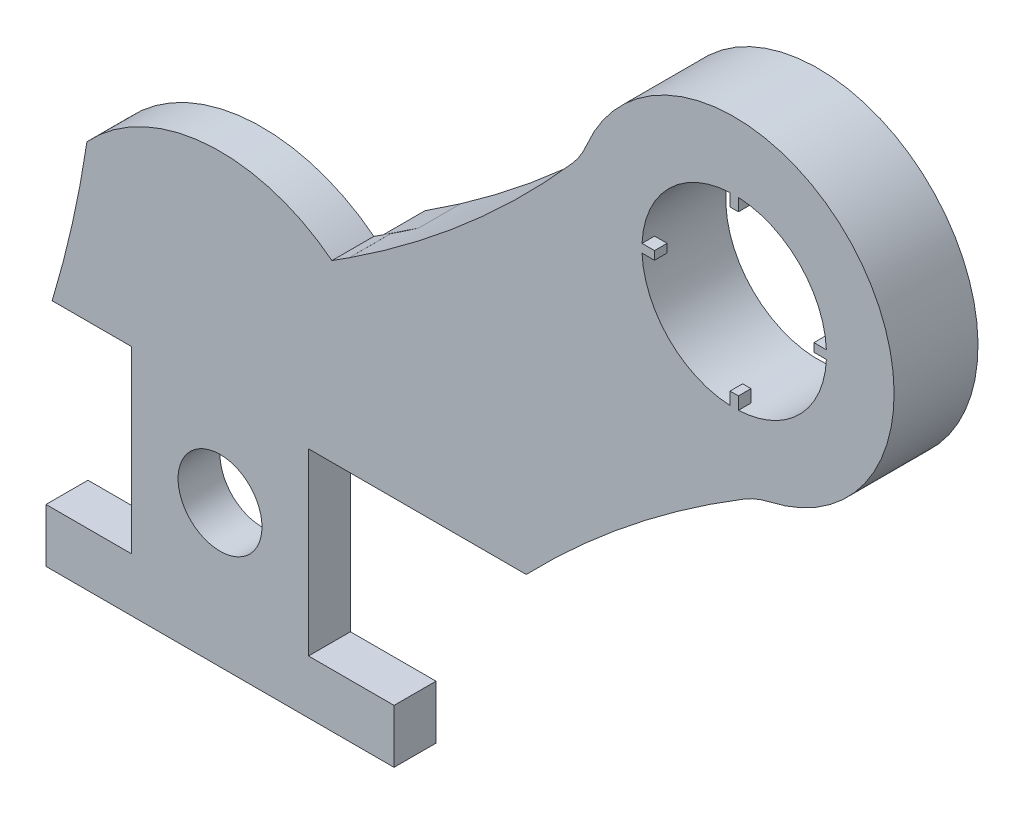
SolidWorks part; units mm, degrees
ref_plane "Front Plane" through (0, 0, 0) normal (0, 0, 1) x (1, 0, 0)
ref_plane "Top Plane" through (0, 0, 0) normal (0, 1, 0) x (1, 0, 0)
ref_plane "Right Plane" through (0, 0, 0) normal (1, 0, 0) x (0, 0, -1)
sketch "Sketch1" plane through (0, 0, 0) normal (0, 0, 1) x (1, 0, 0)
  line L0 (0, 0) -> (0, 70) construction
  line L1 (-53.033, -53.033) -> (0, 0) construction
  line L2 (0, 70) -> (16.2245, 70) construction
  line L3 (0, 70) -> (0, 50) construction
  line L4 (0, 70) -> (-16.2245, 70) construction
  line L5 (0, 0) -> (0, -95.7808) construction
  line L6 (0, 0) -> (53.033, -53.033) construction
  line L8 (-64.561, -58.9899) -> (67.8775, -58.9899) construction
  line L9 (-20.9932, 10.8458) -> (-10.5429, 10.8458) construction
  line L10 (-10.5429, 10.8458) -> (-10.5429, -10.5429) construction
  line L11 (-10.5429, -10.5429) -> (-20.7412, -10.5429) construction
  line L12 (-20.7412, -10.5429) -> (-20.7412, -16.9424) construction
  line L13 (20.7412, -10.5429) -> (20.7412, -16.9424) construction
  line L14 (10.5429, -10.5429) -> (20.7412, -10.5429) construction
  line L15 (10.5429, 10.8458) -> (10.5429, -10.5429) construction
  line L16 (20.9932, 10.8458) -> (10.5429, 10.8458) construction
  line L17 (-20.7412, -16.9424) -> (20.7412, -16.9424) construction
  line L18 (-63.2289, -53.033) -> (63.2289, -53.033) construction
  line L19 (0, 0) -> (-57.4533, -48.2091) construction
  line L20 (0, 0) -> (57.4533, -48.2091) construction
  circle A0 centre (0, 0) radius 5 construction
  arc A1 (-57.4533, -48.2091) -> (-16.2245, 70) centre (-144.7299, 48.5256) ccw
  arc A2 (57.4533, -48.2091) -> (16.2245, 70) centre (144.7299, 48.5256) cw
  arc A3 (-16.2245, 70) -> (16.2245, 70) centre (0, 80) cw
  arc A5 (57.4533, -48.2091) -> (-57.4533, -48.2091) centre (0, 0) cw
  point P20 (0, -106.066)
  dimension "D1" = 10
  dimension "D2" = 75
  dimension "D11" = 19.0587
  dimension "D3" = 70
  dimension "D4" = 5
  dimension "D5" = 5
  dimension "D6" = 41.4824
  dimension "D7" = 21.3887
  dimension "D8" = 6.3996
  dimension "D9" = 21.0858
  dimension "D10" = 6.3995
  dimension "D12" = 10
extrude "Body" add sketch "Sketch1" along normal blind 10
sketch "Sketch2" plane through (0, 0, 10) normal (0, 0, 1) x (1, 0, 0)
  circle A0 centre (0, 0) radius 5
  dimension "D1" = 10
extrude "Attachment Hole" cut sketch "Sketch2" against normal through all
sketch "Sketch17" plane through (0, 0, 10) normal (0, 0, 1) x (1, 0, 0)
  line L0 (-20.9932, 10.8458) -> (-10.5429, 10.8458)
  line L1 (-10.5429, 10.8458) -> (-10.5429, -10.5429)
  line L2 (-10.5429, -10.5429) -> (-20.7412, -10.5429)
  line L3 (-20.7412, -10.5429) -> (-20.7412, -16.9424)
  line L4 (-20.7412, -16.9424) -> (20.7412, -16.9424)
  line L5 (20.7412, -16.9424) -> (20.7412, -10.5429)
  line L6 (20.7412, -10.5429) -> (10.5429, -10.5429)
  line L7 (10.5429, -10.5429) -> (10.5429, 10.8458)
  line L8 (10.5429, 10.8458) -> (20.9932, 10.8458)
  line L9 (0, 0) -> (0, 42.2888) construction
  line L10 (0, 0) -> (0, 70) construction
  line L11 (0, 36.1313) -> (0, -16.9424) construction
  arc A0 (-20.9932, 10.8458) -> (-14.4605, 50.6859) centre (-174.762, 56.5155) ccw
  arc A1 (-57.4533, -48.2091) -> (-16.2245, 70) centre (-144.7299, 48.5256) ccw construction
  arc A2 (20.9932, 10.8458) -> (14.4605, 50.6859) centre (174.762, 56.5155) cw
  arc A3 (-14.4605, 50.6859) -> (14.4605, 50.6859) centre (0, 50.5921) cw
  dimension "D1" = 53.0738
sketch "Sketch34" plane through (0, 0, 10) normal (0, 0, 1) x (1, 0, 0)
  line L0 (-20.9932, 10.8458) -> (-10.5429, 10.8458)
  line L1 (-10.5429, 10.8458) -> (-10.5429, -10.5429)
  line L2 (-10.5429, -10.5429) -> (-20.7412, -10.5429)
  line L3 (-20.7412, -10.5429) -> (-20.7412, -16.9424)
  line L4 (-20.7412, -16.9424) -> (20.7412, -16.9424)
  line L5 (20.7412, -16.9424) -> (20.7412, -10.5429)
  line L6 (20.7412, -10.5429) -> (10.5429, -10.5429)
  line L7 (10.5429, -10.5429) -> (10.5429, 10.8458)
  line L8 (10.5429, 10.8458) -> (20.9932, 10.8458)
  arc A0 (-20.9932, 10.8458) -> (-57.4533, -48.2091) centre (-148.4496, 48.754) cw
  arc A1 (-57.4533, -48.2091) -> (57.4533, -48.2091) centre (0, 0) ccw
  arc A2 (57.4533, -48.2091) -> (20.9932, 10.8458) centre (209.9801, 86.7426) cw
extrude "Cut-Extrude28" cut sketch "Sketch34" against normal through all
sketch "Sketch35" plane through (0, 0, 0) normal (0, 0, -1) x (-1, 0, 0)
  line L0 (20.9932, 10.8458) -> (10.5429, 10.8458)
  line L1 (10.5429, 10.8458) -> (10.5429, -10.5429)
  line L2 (10.5429, -10.5429) -> (20.7412, -10.5429)
  line L3 (20.7412, -10.5429) -> (20.7412, -16.9424)
  line L4 (20.7412, -16.9424) -> (-20.7412, -16.9424)
  line L5 (-20.7412, -16.9424) -> (-20.7412, -10.5429)
  line L6 (-20.7412, -10.5429) -> (-10.5429, -10.5429)
  line L7 (-10.5429, -10.5429) -> (-10.5429, 10.8458)
  line L8 (-10.5429, 10.8458) -> (-20.9932, 10.8458)
  arc A0 (-16.8596, 28.7771) -> (16.8596, 28.7771) centre (0, 14.6091) cw
  arc A1 (-20.9932, 10.8458) -> (-16.8596, 28.7771) centre (-178.7447, 56.6532) ccw
  arc A2 (16.8596, 28.7771) -> (20.9932, 10.8458) centre (154.8947, 51.1552) ccw
extrude "Cut-Extrude30" cut sketch "Sketch35" against normal blind 5
fillet "Fillet1" radius 10 1 edges at (16.2245, 70, 5)
fillet "Fillet2" radius 10 1 edges at (-16.2245, 70, 5)
sketch "Sketch36" plane through (0, 0, 10) normal (0, 0, 1) x (1, 0, 0)
  line L0 (0, 99.0587) -> (0, -16.9424) construction
  line L1 (20.7412, -16.9424) -> (-20.7412, -16.9424) construction
  arc A0 (16.9333, 71.2537) -> (-16.9333, 71.2537) centre (0, 80) ccw construction
  circle A1 centre (0, 80) radius 11
  dimension "D1" = 22
extrude "Cut-Extrude31" cut sketch "Sketch36" against normal blind 10 contours A1
pattern_circular "CirPattern2" count 2 every 50 about axis through (0, 0, 0) along (0, 0, 1) of "Cut-Extrude28", "Cut-Extrude30", "Fillet1", "Fillet2", "Cut-Extrude31", "Body"
sketch "Sketch37" plane through (0, 0, 0) normal (0, 0, -1) x (-1, 0, 0)
  line L0 (10.5429, 10.8458) -> (34.076, 10.8458)
  line L5 (34.076, 10.8458) -> (33.8042, -11.1586)
  line L6 (33.8042, -11.1586) -> (20.7412, -10.5429)
  line L7 (20.7412, -10.5429) -> (10.5429, -10.5429)
  line L8 (20.7412, -10.5429) -> (10.5429, -10.5429) construction
  line L9 (10.5429, -10.5429) -> (10.5429, 10.8458) construction
  line L10 (10.5429, -10.5429) -> (10.5429, 10.8458)
  line L11 (-8.2483, -16.9424) -> (10.5429, -16.9424)
  line L12 (-20.7412, -16.9424) -> (20.7412, -16.9424) construction
  line L13 (10.5429, -16.9424) -> (10.5429, -32.1791)
  line L14 (10.5429, -32.1791) -> (-8.2483, -31.2934)
  line L15 (-8.2483, -31.2934) -> (-8.2483, -16.9424)
  line L16 (-20.7412, -10.5429) -> (-10.5429, -10.5429)
  line L17 (-10.5429, -10.5429) -> (-10.5429, 10.8458)
  line L18 (-10.5429, 10.8458) -> (-10.5429, -10.5429) construction
  line L19 (-10.5429, 10.8458) -> (-26.5425, 10.8458)
  line L20 (-26.5425, 10.8458) -> (-26.5425, -10.5429)
  line L21 (-26.5425, -10.5429) -> (-20.7412, -10.5429)
  line L22 (-23.6419, 102.3329) -> (-23.6419, 42.2679)
  line L23 (-23.6419, 42.2679) -> (50.9321, 42.2679)
  line L24 (50.9321, 42.2679) -> (49.6286, 108.6691)
  line L25 (49.6286, 108.6691) -> (-23.6419, 102.3329)
extrude "Cut-Extrude32" cut sketch "Sketch37" against normal blind 10
sketch "Sketch39" plane through (0, 0, 0) normal (0, 0, -1) x (-1, 0, 0)
  line L0 (-10.5429, 10.8458) -> (-54.2931, 10.8458)
  line L1 (-54.2931, 10.8458) -> (-54.2931, -6.5036)
  line L2 (-54.2931, -6.5036) -> (-10.5429, -4.6732)
  line L3 (-10.5429, 10.8458) -> (-10.5429, -10.5429) construction
  line L4 (-10.5429, -4.6732) -> (-10.5429, 10.8458)
extrude "Cut-Extrude33" cut sketch "Sketch39" against normal blind 10
sketch "Sketch40" plane through (0, 0, 0) normal (0, 0, -1) x (-1, 0, 0)
  line L0 (-15.7228, 46.4867) -> (31.5667, 45.4575)
  line L1 (31.5667, 45.4575) -> (21.2966, 18.2322)
  line L2 (-15.7228, 46.4867) -> (-15.7228, 33.1988)
  line L3 (-15.7228, 33.1988) -> (-13.3366, 31.6668)
  circle A0 centre (0, 14.6895) radius 21.5892
  arc A1 (-41.982, 56.0254) -> (-12.8313, 31.3516) centre (55.8578, 142.0611) ccw construction
extrude "Cut-Extrude35" cut sketch "Sketch40" against normal blind 10 contours A0 L1 L0 L2 L3 M2 M1 M4 M3 | L3 M2 M3 M4 M1
sketch "Sketch41" plane through (0, 0, 0) normal (0, 0, -1) x (-1, 0, 0)
  line L4 (-18.6719, 35.1963) -> (-37.4906, 11.8598)
  line L5 (-18.6719, 35.1963) -> (-5.0507, 30.6503)
  line L6 (-5.0507, 30.6503) -> (-24.2234, -3.1182)
  line L7 (-24.2234, -3.1182) -> (-39.3191, 4.5175)
  line L8 (-39.3191, 4.5175) -> (-37.4906, 11.8598)
  arc A0 (-41.982, 56.0254) -> (-12.8313, 31.3516) centre (55.8578, 142.0611) ccw construction
  arc A1 (-36.5003, 10.8458) -> (-62.4643, 31.6155) centre (-130.2033, -79.6779) ccw construction
  arc A2 (-12.8313, 31.3516) -> (-33.1653, 10.8458) centre (-11.1912, 9.3906) ccw construction
extrude "Cut-Extrude39" cut sketch "Sketch41" against normal blind 5
sketch "Sketch42" plane through (0, 0, 5) normal (0, 0, -1) x (-1, 0, 0)
  line L0 (-37.4906, 11.8598) -> (-36.5003, 10.8458)
  line L1 (-36.5003, 10.8458) -> (-22.7057, 10.8458)
  line L2 (-10.5429, 10.8458) -> (-36.5003, 10.8458) construction
  line L3 (-22.7057, 10.8458) -> (-19.8618, 22.2082)
  line L4 (-14.4169, 32.3513) -> (-18.6719, 35.1963)
  line L5 (-18.6719, 35.1963) -> (-37.4906, 11.8598)
  arc A0 (-19.8618, 22.2082) -> (-14.4169, 32.3513) centre (2.9407, 16.5008) cw
  arc A1 (-18.6719, 35.1963) -> (4.5539, 22.3002) centre (55.8578, 142.0611) ccw construction
extrude "Boss-Extrude1" add sketch "Sketch42" along normal up to surface (5 mm away)
sketch "Sketch43" plane through (0, 0, 10) normal (0, 0, -1) x (-1, 0, 0)
  line L1 (-61.7836, 38.923) -> (-60.7836, 38.923)
  line L2 (-61.7836, 38.923) -> (-61.7836, 41.923)
  line L3 (-61.7836, 41.923) -> (-60.7836, 41.923)
  line L4 (-60.7836, 38.923) -> (-60.7836, 41.923)
  line L5 (-61.7836, 38.923) -> (-60.7836, 41.923) construction
  line L6 (-61.7836, 41.923) -> (-60.7836, 38.923) construction
  line L7 (-51.7836, 50.923) -> (-48.7836, 50.923)
  line L8 (-51.7836, 50.923) -> (-51.7836, 51.923)
  line L9 (-51.7836, 51.923) -> (-48.7836, 51.923)
  line L10 (-48.7836, 50.923) -> (-48.7836, 51.923)
  line L11 (-51.7836, 50.923) -> (-48.7836, 51.923) construction
  line L12 (-51.7836, 51.923) -> (-48.7836, 50.923) construction
  line L13 (-61.7836, 63.923) -> (-60.7836, 63.923)
  line L14 (-61.7836, 63.923) -> (-61.7836, 60.923)
  line L15 (-61.7836, 60.923) -> (-60.7836, 60.923)
  line L16 (-60.7836, 63.923) -> (-60.7836, 60.923)
  line L17 (-61.7836, 63.923) -> (-60.7836, 60.923) construction
  line L18 (-61.7836, 60.923) -> (-60.7836, 63.923) construction
  line L19 (-73.7836, 50.923) -> (-70.7836, 50.923)
  line L20 (-73.7836, 50.923) -> (-73.7836, 51.923)
  line L21 (-73.7836, 51.923) -> (-70.7836, 51.923)
  line L22 (-70.7836, 50.923) -> (-70.7836, 51.923)
  line L23 (-73.7836, 50.923) -> (-70.7836, 51.923) construction
  line L24 (-73.7836, 51.923) -> (-70.7836, 50.923) construction
  circle A0 centre (-61.2836, 51.423) radius 11 construction
  point P0 (-61.2836, 40.423)
  point P7 (-50.2836, 51.423)
  point P12 (-61.2836, 62.423)
  point P17 (-72.2836, 51.423)
  dimension "D1" = 1
  dimension "D2" = 1
  dimension "D3" = 1
  dimension "D4" = 1
  dimension "D5" = 3
  dimension "D6" = 3
  dimension "D7" = 3
  dimension "D8" = 3
extrude "Boss-Extrude2" add sketch "Sketch43" along normal blind 1.5
